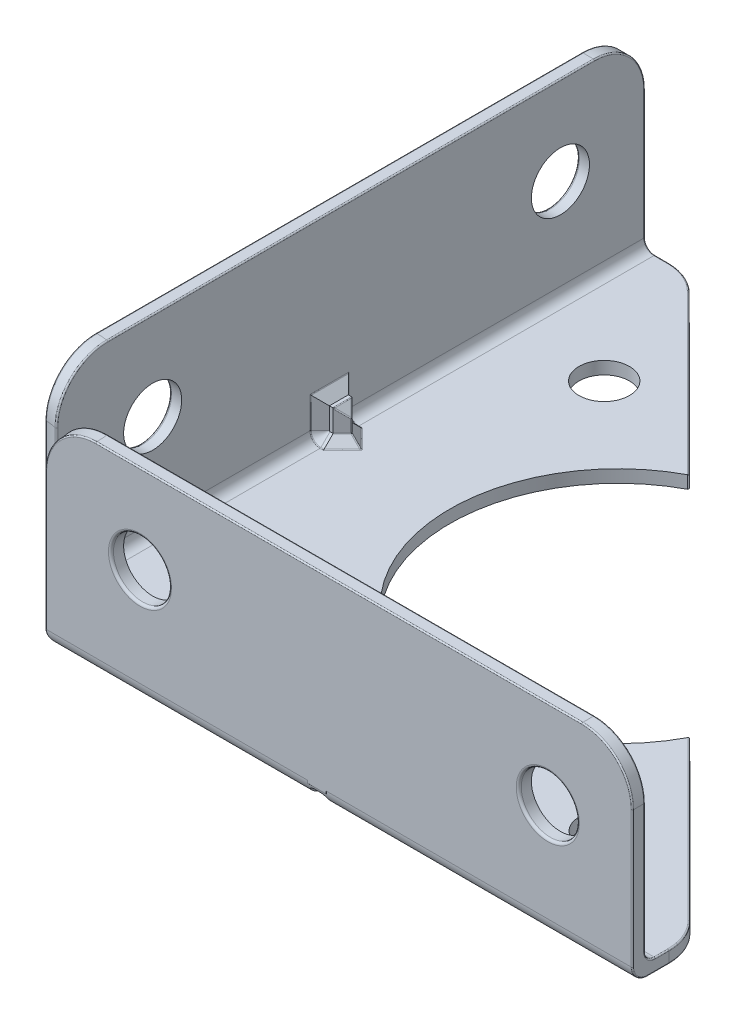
SolidWorks part; units mm, degrees
ref_plane "Front Plane" through (0, 0, 0) normal (0, 0, 1) x (1, 0, 0)
ref_plane "Top Plane" through (0, 0, 0) normal (0, 1, 0) x (1, 0, 0)
ref_plane "Right Plane" through (0, 0, 0) normal (1, 0, 0) x (0, 0, -1)
sketch "Sketch1" plane through (0, 0, 0) normal (0, 1, 0) x (1, 0, 0)
  line L0 (0, 0) -> (50, 50) construction
  line L1 (0, 0) -> (50, 0) construction
  line L2 (0, 0) -> (0, 50) construction
  line L3 (0, 50) -> (50, 50) construction
  line L4 (50, 0) -> (50, 50) construction
  line L5 (3.5, 0) -> (50, 0)
  line L6 (50, 0) -> (50, 4.5598)
  line L7 (0, 3.5) -> (0, 50)
  line L8 (0, 50) -> (4.5, 50)
  line L9 (4.5, 50) -> (50, 4.5598)
  arc A0 (0, 3.5) -> (3.5, 0) centre (0, 0) cw
  circle A1 centre (15.3, 15.3) radius 3.1
extrude "Boss-Extrude1" add sketch "Sketch1" along normal blind 16 contours L7 L8 L9 L6 L5 A0
sketch "Sketch2" plane through (0, 16, 0) normal (0, 1, 0) x (1, 0, 0)
  line L0 (1, 50) -> (4.5, 50)
  line L1 (0, 50) -> (1, 50) construction
  line L2 (0, 50) -> (0, 3) construction
  line L5 (50, 0) -> (3.5, 0)
  line L6 (50, 0) -> (50, 1) construction
  line L9 (4.5, 50) -> (50, 4.5598)
  line L10 (50, 4.5598) -> (50, 1)
  line L14 (3.349, 1) -> (50, 1)
  line L15 (0, 50) -> (1, 50) construction
  line L16 (0, 50) -> (0, 0) construction
  line L17 (0, 0) -> (1, 0) construction
  line L18 (1, 50) -> (1, 0) construction
  line L19 (0, 0) -> (50, 0) construction
  line L20 (0, 0) -> (0, 1) construction
  line L21 (0, 1) -> (50, 1) construction
  line L22 (50, 0) -> (50, 1) construction
  line L23 (1, 3.349) -> (1, 50)
  arc A0 (0, 3.5) -> (3.5, 0) centre (0, 0) cw construction
  arc A2 (1, 3.349) -> (3.349, 1) centre (0, 0) cw
extrude "Cut-Extrude1" cut sketch "Sketch2" against normal blind 15
fillet "Fillet1" radius 0.8 2 edges at (26.6771, 1, -1) (1, 1, -26.6771)
fillet "Fillet2" radius 1.2 3 edges at (0, 0, -26.75) (26.75, 0, 0) (2.4749, 0, -2.4749)
fillet "Fillet3" radius 4 1 edges at (0.5, 16, -50)
fillet "Fillet4" radius 4 1 edges at (50, 16, -0.5)
fillet "Fillet5" radius 4 2 edges at (3.4633, 16, -0.5053) (0.5053, 16, -3.4633)
sketch "Sketch3"
sketch_block_instance "Block2-1"
sketch_block "Block2" parameters "D1"=1.3044
extrude "Cut-Extrude2" cut sketch "Sketch3" against normal blind 20
sketch "Sketch4" plane through (0, 0, -1) normal (0, 0, -1) x (-1, 0, 0)
  circle B0 centre (-11, 9) radius 2.3
  circle B1 centre (-43.3, 9) radius 2.3
sketch_block_instance "Block2-6"
extrude "Cut-Extrude3" cut sketch "Sketch4" against normal blind 20
fillet "Fillet6" radius 4 2 edges at (50, 0.5, -4.5598) (4.5, 0.5, -50)
fillet "Fillet7" radius 0.2 4 edges at (0, 9, -41) (0, 9, -8.7) (8.7, 9, 0) (41, 9, 0)
sketch "Sketch5" plane through (0, 1, 0) normal (0, 1, 0) x (1, 0, 0)
  line B0 (0, 0) -> (0, 25) construction
  line B1 (0, 25) -> (0, 26.2) construction
  line B2 (0, 25) -> (0, 23.8) construction
  line B3 (0, 24.25) -> (0, 25.75)
  line B4 (0, 0) -> (25, 0) construction
  line B5 (0, 24.25) -> (0, 25.75)
  line B6 (0, 24.25) -> (2.8, 24.25)
  line B7 (2.8, 24.25) -> (2.8, 25.75)
  line B8 (0, 25.75) -> (2.8, 25.75)
  line B9 (25, 0) -> (26.2, 0) construction
  line B10 (25, 0) -> (23.8, 0) construction
  line B11 (24.25, 0) -> (25.75, 0)
  line B12 (24.25, 0) -> (24.25, 2.8)
  line B13 (24.25, 0) -> (25.75, 0)
  line B14 (25.75, 0) -> (25.75, 2.8)
  line B15 (24.25, 2.8) -> (25.75, 2.8)
sketch_block_instance "Block4-2"
sketch_block "Block4" parameters "D1"=26.75
sketch "Sketch7" plane through (0, 0, 0) normal (0, -1, 0) x (1, 0, 0)
  line B0 (0, 0) -> (25, 0) construction
  line B1 (25, 0) -> (26.2, 0) construction
  line B2 (25, 0) -> (23.8, 0) construction
  line B3 (24.25, 0) -> (25.75, 0)
  line B4 (0, 0) -> (0, -25) construction
  line B5 (24.25, 0) -> (25.75, 0)
  line B6 (24.25, 0) -> (24.25, -2.8)
  line B7 (24.25, -2.8) -> (25.75, -2.8)
  line B8 (25.75, 0) -> (25.75, -2.8)
  line B9 (0, -25) -> (0, -26.2) construction
  line B10 (0, -25) -> (0, -23.8) construction
  line B11 (0, -24.25) -> (0, -25.75)
  line B12 (0, -24.25) -> (2.8, -24.25)
  line B13 (0, -24.25) -> (0, -25.75)
  line B14 (0, -25.75) -> (2.8, -25.75)
  line B15 (2.8, -24.25) -> (2.8, -25.75)
sketch_block_instance "Block4-1" parameters "D1"=1.5
extrude "Boss-Extrude3" add sketch "Sketch5" along normal blind 2.5
extrude "Cut-Extrude6" cut sketch "Sketch7" against normal blind 0.8
chamfer "Chamfer4" distance 0.75 angle 45 22 edges at (2.8, 2.25, -24.25) (2.8, 3.5, -25) (2.8, 2.25, -25.75) (1, 2.65, -24.25) (1, 3.5, -25) (1, 2.65, -25.75) (24.25, 2.65, -1) (24.25, 1.2343, -1.2343) (24.25, 1, -2.3) (25, 1, -2.8) (25.75, 1, -2.3) (25.75, 1.2343, -1.2343) (25, 3.5, -1) (25.75, 2.65, -1) (24.25, 2.25, -2.8) (25, 3.5, -2.8) (25.75, 2.25, -2.8) (2.3, 1, -24.25) (2.8, 1, -25) (2.3, 1, -25.75) (1.2343, 1.2343, -24.25) (1.2343, 1.2343, -25.75)
fillet "Fillet14" radius 0.5 6 edges at (1.4343, 0.8, -24.25) (2.8, 0.8, -25) (1.4343, 0.8, -25.75) (25, 0.8, -2.8) (25.75, 0.8, -1.4343) (24.25, 0.8, -1.4343)
fillet "Fillet16" radius 0.1 41 edges at (3.6554, 0.6033, -0.1589) (3.5, 6.6, 0) (4.6716, 14.8284, 0) (0.1589, 0.6033, -3.6554) (0, 6.6, -3.5) (0, 14.8284, -4.6716) (0, 16, -26.75) (0, 14.8284, -48.8284) (0, 6.6, -50) (0.3515, 0.3515, -50) (2.0223, 0, -50) (4.3742, 0, -49.696) (27.2489, 0, -27.281) (49.695, 0, -4.4334) (50, 0, -2.0507) (50, 0.3515, -0.3515) (50, 6.6, 0) (48.8284, 14.8284, 0) (1, 15.1014, -4.8723) (1, 6.9, -3.3541) (1.0968, 1.4185, -3.3237) (1.505, 1.0564, -3.1695) (2.4867, 1, -2.4867) (3.1556, 1.0444, -1.5373) (3.3414, 1.5454, -1.0416) (3.3541, 6.9, -1) (4.207, 14.4319, -1) (26.7165, 16, -1) (48.8284, 14.8284, -1) (50, 6.9, -1) (50, 1.2343, -1.2343) (50, 1, -2.3507) (49.695, 1, -4.4334) (27.2489, 1, -27.281) (4.3742, 1, -49.696) (2.3223, 1, -50) (1.2343, 1.2343, -50) (1, 6.9, -50) (1, 14.8284, -48.8284) (26.75, 16, 0) (1, 16, -26.7165)
fillet "Fillet19" radius 0.1 33 edges at (26.5, 1, -1.925) (26.125, 1, -2.425) (25.375, 1, -3.175) (24.625, 1, -3.175) (23.875, 1, -2.425) (23.5, 1, -1.925) (1.925, 1, -23.5) (2.425, 1, -23.875) (3.175, 1, -24.625) (3.175, 1, -25.375) (2.425, 1, -26.125) (1.925, 1, -26.5) (2.05, 3.5, -25) (1.2343, 1.2343, -23.5) (1.2343, 1.2343, -26.5) (1, 3.025, -26.5) (1, 4.25, -25) (1, 3.025, -23.5) (26.5, 3.025, -1) (25, 4.25, -1) (23.5, 3.025, -1) (23.5, 1.2343, -1.2343) (26.5, 1.2343, -1.2343) (2.425, 3.125, -24.625) (2.8, 2.25, -25) (2.425, 3.125, -25.375) (2.425, 1.75, -24.625) (2.425, 1.75, -25.375) (3.175, 1.375, -25) (25.375, 1.75, -2.425) (25.375, 3.125, -2.425) (24.625, 3.125, -2.425) (24.625, 1.75, -2.425)
fillet "Fillet20" radius 0.1 5 edges at (25, 1.3832, -3.1668) (25, 2.2305, -2.8) (25, 1.0112, -3.5582) (25, 2.75, -2.7811) (25, 1.7515, -2.8066)
scale "Scale2" scale about centroid uniform scaling yes scale factor 1.5
hole_wizard "M7x1.0 Tapped Hole1" positions "Sketch9" profile "Sketch10" tap size "M7x1.0" standard "ANSI Metric"
sketch "Sketch9" plane through (0, -0.6384, 0) normal (0, 1, 0) x (1, 0, 0)
  line L0 (65.126, 0.4867) -> (0.393, 65.1345) construction
  line L1 (65.126, 0.4867) -> (0.393, 65.1345) construction
  point P0 (4.6402, 51)
  point P2 (51, 4.7011)
  dimension "D1" = 7
  dimension "D2" = 51
  dimension "D3" = 51
  dimension "D4" = 7
sketch "Sketch10" plane through (4.6402, -0.6384, -51) normal (1, 0, 0) x (0, 0, 1)
  line L0 (0, 0) -> (0, 18.8026)
  line L1 (0, 18.8026) -> (3, 17)
  line L2 (3, 17) -> (3, 0)
  line L5 (3, 0) -> (0, 0)
  line L10 (0, 18.8026) -> (-3, 17) construction
  line L11 (0, -6.35) -> (0, 107.95) construction
  dimension "Tap Drill Dia." = 6
  dimension "Tap Drill Depth" = 17
  dimension "Drill Angle" = 118
sketch "Sketch11" plane through (0, -0.6384, 0) normal (0, 1, 0) x (1, 0, 0)
  line L0 (28.6384, 28.6587) -> (32.8655, 32.9168) construction
  line L6 (66.8422, -5.3047) -> (66.8422, -3.6526) construction
  line L7 (65.232, 0.5928) -> (0.499, 65.2407) construction
  line L9 (17.1266, 48.6349) -> (49.7101, 16.0515)
  arc A0 (19.3766, 46.3849) -> (46.3646, 19.397) centre (28.6384, 28.6587) ccw
  dimension "D1" = 20
  dimension "D2" = 6
  dimension "D4" = 46.0799
  dimension "D7" = 23.5
  dimension "D8" = 17.1321
extrude "Cut-Extrude7" cut sketch "Sketch11" against normal blind 10 and the other way through all
sketch "Sketch13" plane through (32.8695, 0, -32.9128) normal (0.7066, 0, -0.7076) x (-0.7076, 0, -0.7066)
  line L0 (-19.1376, -2.1384) -> (19.113, -2.1384)
  line L2 (-19.1376, -2.1384) -> (-19.1376, -0.6384)
  line L4 (-19.1376, -0.6384) -> (19.113, -0.6384)
  line L5 (19.113, -0.6384) -> (19.113, -2.1384)
extrude "Cut-Extrude8" cut sketch "Sketch13" against normal blind 5
